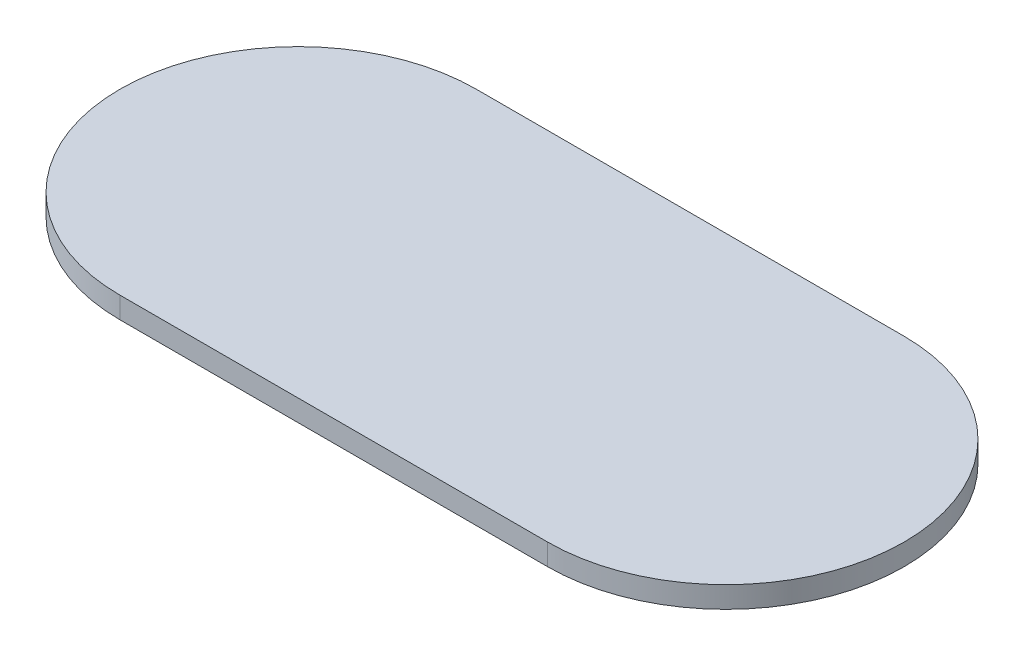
SolidWorks part; units mm, degrees
other "Published References"
other "Ground Plane"
ref_plane "Front Plane" through (0, 0, 0) normal (0, 0, 1) x (1, 0, 0)
ref_plane "Top Plane" through (0, 0, 0) normal (0, 1, 0) x (1, 0, 0)
ref_plane "Right Plane" through (0, 0, 0) normal (1, 0, 0) x (0, 0, -1)
sketch "Sketch1" plane through (0, 0, 0) normal (0, 1, 0) x (1, 0, 0)
  line L0 (-150, 0) -> (150, 0) construction
  line L1 (-150, 125) -> (150, 125)
  line L2 (-150, -125) -> (150, -125)
  arc A0 (-150, 125) -> (-150, -125) centre (-150, 0) ccw
  arc A1 (150, -125) -> (150, 125) centre (150, 0) ccw
  point P2 (0, 0)
  dimension "D1" = 250
  dimension "D2" = 300
extrude "Boss-Extrude1" add sketch "Sketch1" along normal mid plane 15
